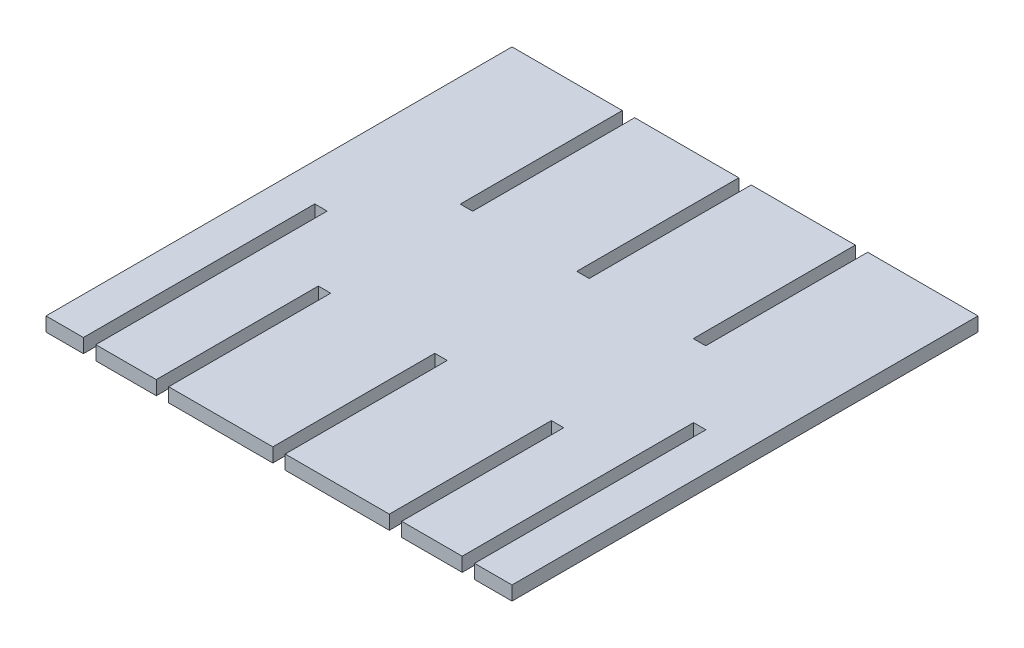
SolidWorks part; units mm, degrees
ref_plane "Alzado" through (0, 0, 0) normal (0, 0, 1) x (1, 0, 0)
ref_plane "Planta" through (0, 0, 0) normal (0, 1, 0) x (1, 0, 0)
ref_plane "Vista lateral" through (0, 0, 0) normal (1, 0, 0) x (0, 0, -1)
sketch "Croquis2" plane through (0, 0, 0) normal (0, 1, 0) x (1, 0, 0)
  line L0 (49.825, -7.5998) -> (49.825, 56.9115) construction
  line L1 (0, 0) -> (8, 0)
  line L2 (0, 0) -> (0, 99.65)
  line L3 (0, 99.65) -> (23.585, 99.65)
  line L4 (99.65, 0) -> (99.65, 99.65)
  line L6 (8, 0) -> (8, 49.475)
  line L7 (8, 49.475) -> (10.65, 49.475)
  line L8 (10.65, 0) -> (10.65, 49.475)
  line L9 (91.65, 49.475) -> (89, 49.475)
  line L10 (89, 0) -> (89, 49.475)
  line L12 (91.65, 0) -> (91.65, 49.475)
  line L13 (10.65, 0) -> (23.585, 0)
  line L14 (91.65, 0) -> (99.65, 0)
  line L15 (49.825, 56.9115) -> (49.825, 100.3984) construction
  line L17 (48.5, 99.65) -> (48.5, 65)
  line L18 (48.5, 65) -> (51.15, 65)
  line L19 (51.15, 99.65) -> (51.15, 65)
  line L20 (51.15, 99.65) -> (73.415, 99.65)
  line L21 (-11.3877, 49.83) -> (119.4419, 49.83) construction
  line L22 (51.15, 0) -> (73.415, 0)
  line L24 (51.15, 0) -> (51.15, 34.65)
  line L25 (51.15, 34.65) -> (48.5, 34.65)
  line L26 (48.5, 0) -> (48.5, 34.65)
  line L27 (73.415, 99.65) -> (73.415, 65)
  line L28 (76.065, 99.65) -> (76.065, 65)
  line L29 (73.415, 65) -> (76.065, 65)
  line L30 (23.585, 99.65) -> (23.585, 65)
  line L31 (26.235, 99.65) -> (26.235, 65)
  line L32 (23.585, 65) -> (26.235, 65)
  line L33 (26.235, 99.65) -> (48.5, 99.65)
  line L34 (76.065, 99.65) -> (99.65, 99.65)
  line L35 (73.415, 0) -> (73.415, 34.65)
  line L36 (76.065, 0) -> (76.065, 34.65)
  line L37 (76.065, 34.65) -> (73.415, 34.65)
  line L38 (26.235, 0) -> (26.235, 34.65)
  line L39 (23.585, 0) -> (23.585, 34.65)
  line L40 (26.235, 34.65) -> (23.585, 34.65)
  line L41 (26.235, 0) -> (48.5, 0)
  line L42 (76.065, 0) -> (89, 0)
extrude "Saliente-Extruir1" add sketch "Croquis2" along normal blind 3
equation "\"ladoLC\"= 100 - \"kerf\" / 2"
equation "\"D1@Croquis2\"=\"ladoLC\""
equation "\"ladoAC\"= 100 - \"kerf\" / 2"
equation "\"D2@Croquis2\"=\"ladoAC\""
equation "\"ladoLE\" = \"ladoLC\" / 2 - \"kerf\" / 2"
equation "\"D3@Croquis2\"=\"ladoLE\""
equation "\"ladoAE\"= 3 - \"kerf\" / 2"
equation "\"D4@Croquis2\"=\"ladoAE\""
equation "\"D6@Croquis2\"=\"ladoLC\"/2"
equation "\"kerf\"= 0.7"
equation "\"D8@Croquis2\"=\"ladoAE\""
equation "\"h\" = \"h\""
equation "\"ensamble\"= 35 - \"kerf\" / 2"
equation "\"D7@Croquis2\"=\"ensamble\""
equation "\"lineaensamble\"=14.825"
equation "\"D11@Croquis2\"=\"ensamble\""
equation "\"D12@Croquis2\"=\"ladoAE\""
equation "\"D10@Croquis2\"=\"ladoLC\"/2"
